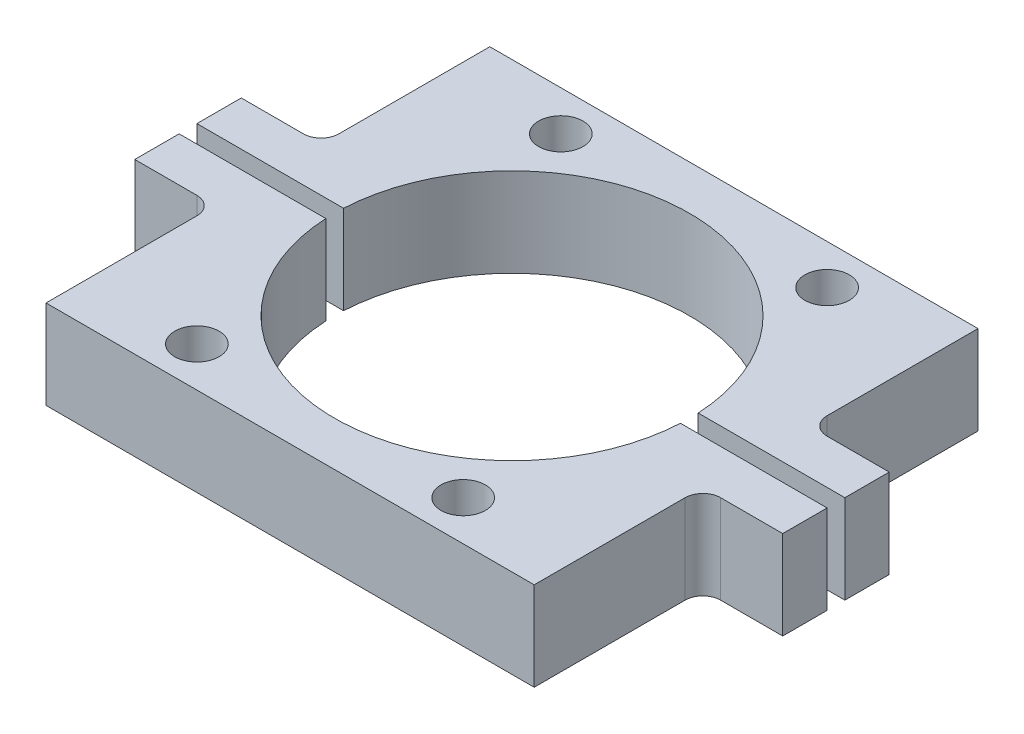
SolidWorks part; units mm, degrees
ref_plane "Front Plane" through (0, 0, 0) normal (0, 0, 1) x (1, 0, 0)
ref_plane "Top Plane" through (0, 0, 0) normal (0, 1, 0) x (1, 0, 0)
ref_plane "Right Plane" through (0, 0, 0) normal (1, 0, 0) x (0, 0, -1)
sketch "Sketch1" plane through (0, 0, 0) normal (0, 1, 0) x (1, 0, 0)
  line L0 (-73, -2) -> (-73, -12)
  line L1 (55, -50) -> (-55, -50)
  line L2 (55, -50) -> (55, -12)
  line L3 (55, 50) -> (-55, 50)
  line L4 (-55, -50) -> (-55, -12)
  line L5 (55, -50) -> (-55, 50) construction
  line L6 (55, 50) -> (-55, -50) construction
  line L7 (73, 12) -> (55, 12)
  line L8 (73, 12) -> (73, 2)
  line L9 (73, -12) -> (55, -12)
  line L10 (-73, 12) -> (-73, 2)
  line L11 (73, -2) -> (39.95, -2)
  line L12 (-55, -12) -> (-73, -12)
  line L13 (73, 2) -> (39.95, 2)
  line L14 (-55, 12) -> (-55, 50)
  line L15 (-55, 12) -> (-73, 12)
  line L16 (55, 12) -> (55, 50)
  line L17 (73, -2) -> (73, -12)
  line L18 (-39.95, 2) -> (-73, 2)
  line L19 (-39.95, -2) -> (-73, -2)
  arc A0 (39.95, 2) -> (-39.95, 2) centre (0, 0) ccw
  arc A1 (-39.95, -2) -> (39.95, -2) centre (0, 0) ccw
extrude "Boss-Extrude1" add sketch "Sketch1" along normal blind 20
sketch "Sketch2" plane through (0, 0, 0) normal (0, 1, 0) x (1, 0, 0)
  circle A1 centre (30, 41) radius 5
  circle A2 centre (-30, -41) radius 5
  circle A3 centre (-30, 41) radius 5
  circle A4 centre (30, -41) radius 5
  dimension "D1" = 10
  dimension "D2" = 30
  dimension "D3" = 30
  dimension "D4" = 30
  dimension "D5" = 41
  dimension "D6" = 41
  dimension "D7" = 41
extrude "Cut-Extrude2" cut sketch "Sketch2" along normal blind 20
fillet "Fillet1" radius 4 2 edges at (-55, 10, -12) (55, 10, -12)
fillet "Fillet2" radius 4 2 edges at (-55, 10, 12) (55, 10, 12)
